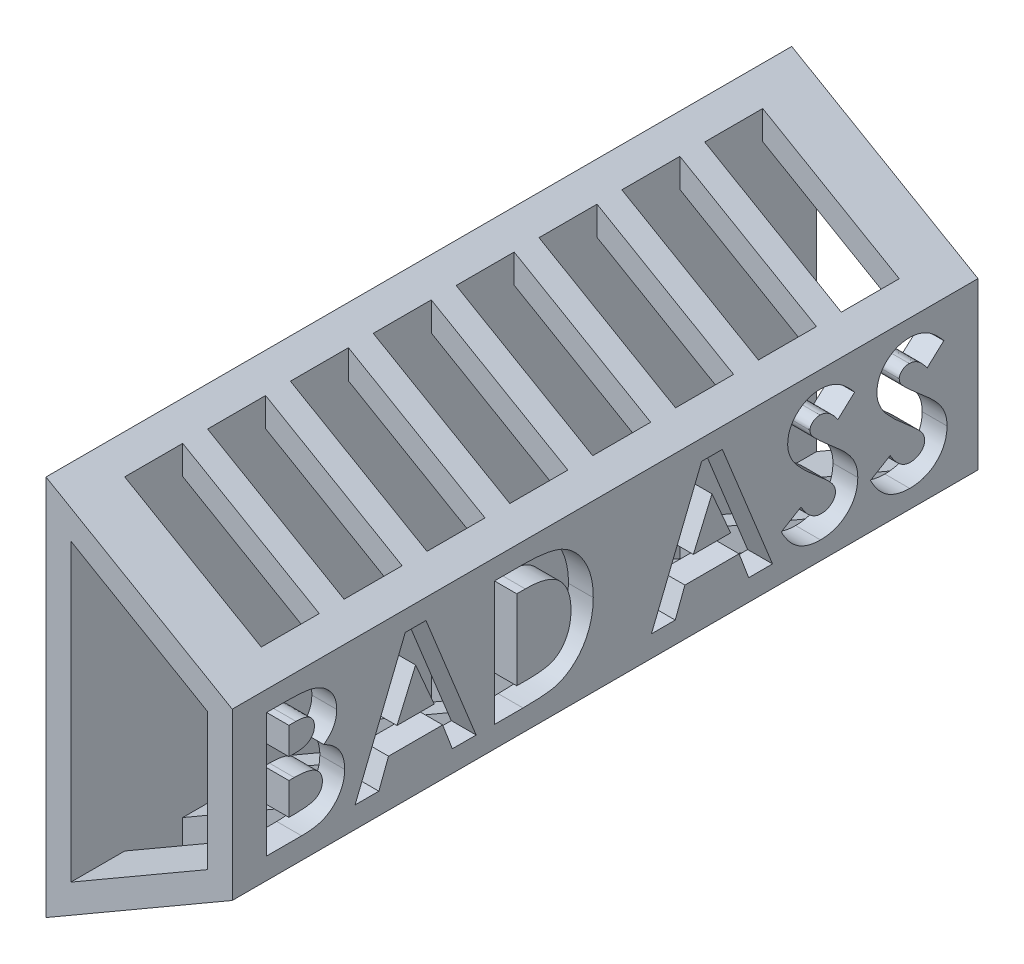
SolidWorks part; units mm, degrees
ref_plane "Front Plane" through (0, 0, 0) normal (0, 0, 1) x (1, 0, 0)
ref_plane "Top Plane" through (0, 0, 0) normal (0, 1, 0) x (1, 0, 0)
ref_plane "Right Plane" through (0, 0, 0) normal (1, 0, 0) x (0, 0, -1)
sketch "Sketch1" plane through (0, 0, 0) normal (0, 0, 1) x (1, 0, 0)
  line L0 (0, 0) -> (0, 181.0461)
  line L1 (0, 0) -> (83.7138, 48.5061)
  line L2 (83.7138, 48.5061) -> (83.7138, 132.54)
  line L3 (0, 181.0461) -> (83.7138, 132.54)
  line L4 (-15.24, -26.444) -> (-15.24, 207.49)
  line L5 (-15.24, 207.49) -> (98.9538, 141.323)
  line L6 (98.9538, 39.723) -> (98.9538, 141.323)
  line L7 (-15.24, -26.444) -> (98.9538, 39.723)
  dimension "D1" = 233.934
  dimension "D2" = 101.6
  dimension "D3" = 131.9784
  dimension "D5" = 15.24
extrude "Boss-Extrude1" add sketch "Sketch1" against normal blind 457.2
sketch "Sketch2" plane through (0, 0, 0) normal (0, 1, 0) x (1, 0, 0)
  line L0 (0, 424.18) -> (83.7138, 424.18)
  line L1 (83.7138, 424.18) -> (83.7138, 388.62)
  line L2 (83.7138, 388.62) -> (0, 388.62)
  line L3 (0, 388.62) -> (0, 424.18)
  line L4 (0, 373.38) -> (0, 337.82)
  line L5 (0, 337.82) -> (83.7138, 337.82)
  line L6 (83.7138, 337.82) -> (83.7138, 373.38)
  line L7 (83.7138, 373.38) -> (0, 373.38)
  line L8 (98.9538, 457.2) -> (-15.24, 457.2) construction
  line L9 (98.9538, 457.2) -> (98.9538, 0) construction
  line L10 (0, 119.38) -> (83.7138, 119.38)
  line L11 (0, 322.58) -> (0, 287.02)
  line L12 (0, 287.02) -> (83.7138, 287.02)
  line L13 (83.7138, 287.02) -> (83.7138, 322.58)
  line L14 (83.7138, 322.58) -> (0, 322.58)
  line L15 (0, 271.78) -> (83.7138, 271.78)
  line L16 (83.7138, 271.78) -> (83.7138, 236.22)
  line L17 (83.7138, 236.22) -> (0, 236.22)
  line L18 (0, 236.22) -> (0, 271.78)
  line L19 (0, 220.98) -> (83.7138, 220.98)
  line L20 (83.7138, 220.98) -> (83.7138, 185.42)
  line L21 (83.7138, 185.42) -> (0, 185.42)
  line L22 (0, 185.42) -> (0, 220.98)
  line L23 (83.7138, 119.38) -> (83.7138, 83.82)
  line L24 (0, 83.82) -> (0, 119.38)
  line L25 (83.7138, 83.82) -> (0, 83.82)
  line L26 (0, 68.58) -> (83.7138, 68.58)
  line L27 (83.7138, 68.58) -> (83.7138, 33.02)
  line L28 (0, 33.02) -> (0, 68.58)
  line L29 (83.7138, 33.02) -> (0, 33.02)
  line L30 (0, 170.18) -> (83.7138, 170.18)
  line L31 (83.7138, 170.18) -> (83.7138, 134.62)
  line L32 (0, 134.62) -> (0, 170.18)
  line L33 (83.7138, 134.62) -> (0, 134.62)
  line L34 (98.9538, 0) -> (-15.24, 0) construction
  dimension "D1" = 33.02
  dimension "D2" = 15.24
  dimension "D3" = 35.56
  dimension "D4" = 15.24
  dimension "D5" = 35.56
  dimension "D6" = 15.24
  dimension "D7" = 15.24
  dimension "D8" = 15.24
  dimension "D9" = 15.24
  dimension "D10" = 15.24
  dimension "D11" = 15.24
  dimension "D12" = 33.02
extrude "Cut-Extrude1" cut sketch "Sketch2" along normal through all and the other way through all
sketch "Sketch3" plane through (98.9538, 0, 0) normal (1, 0, 0) x (0, 0, -1)
  text T0 "<b>BAD ASS</b>" font "Century Gothic" height 76.2
  dimension "D1" = 52.8157
  dimension "D2" = 12.268
extrude "Cut-Extrude2" cut sketch "Sketch3" against normal up to surface (15.24 mm away)
